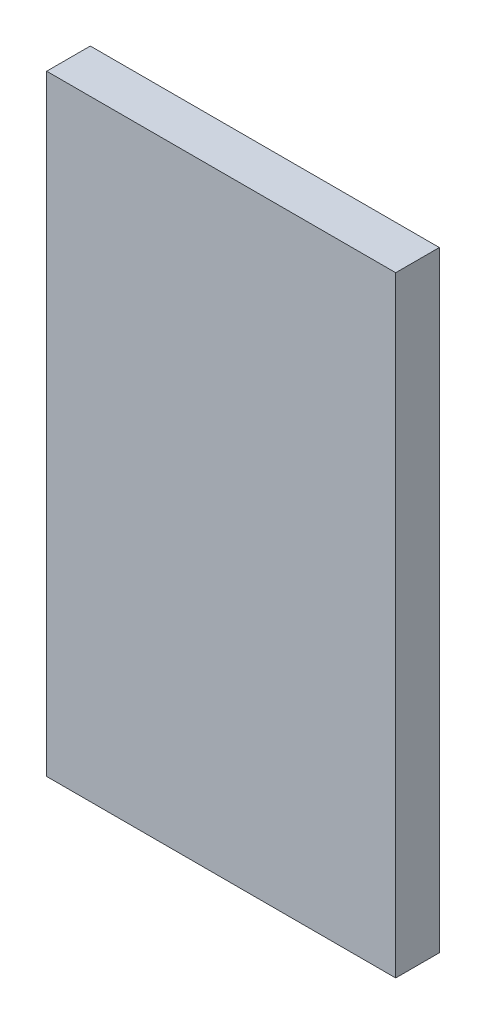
SolidWorks part; units mm, degrees
ref_plane "Plan1" through (0, 0, 0) normal (0, 0, 1) x (1, 0, 0)
ref_plane "Plan2" through (0, 0, 0) normal (0, 1, 0) x (1, 0, 0)
ref_plane "Plan3" through (0, 0, 0) normal (1, 0, 0) x (0, 0, -1)
sketch "Esquisse1" plane through (0, 0, 0) normal (0, 0, 1) x (1, 0, 0)
  line L1 (0, 0) -> (40, 0)
  line L2 (0, 0) -> (0, 70)
  line L3 (0, 70) -> (40, 70)
  line L4 (40, 0) -> (40, 70)
  dimension "D1" = 40
  dimension "D2" = 70
extrude "Extrusion1" add sketch "Esquisse1" along normal blind 5
